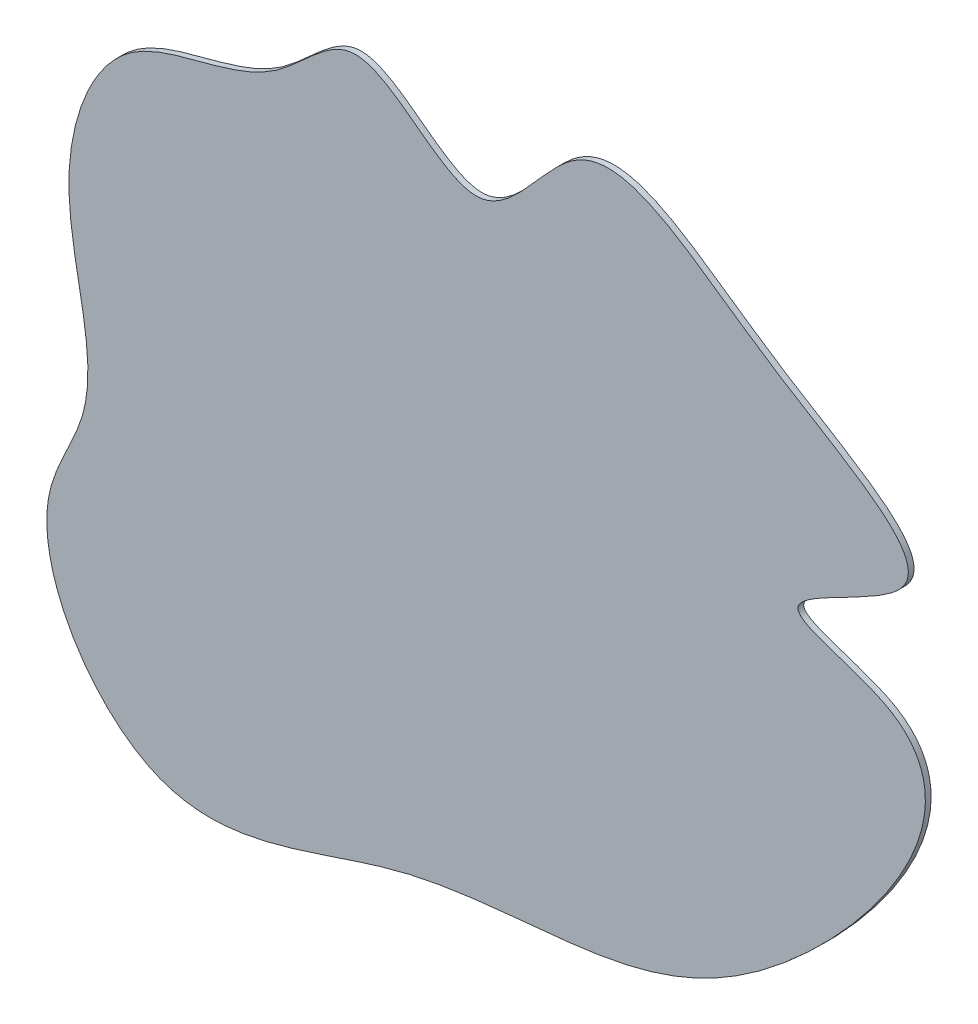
SolidWorks part; units mm, degrees
ref_plane "Plan de face" through (0, 0, 0) normal (0, 0, 1) x (1, 0, 0)
ref_plane "Plan de dessus" through (0, 0, 0) normal (0, 1, 0) x (1, 0, 0)
ref_plane "Plan de droite" through (0, 0, 0) normal (1, 0, 0) x (0, 0, -1)
sketch "Esquisse1" plane through (0, 0, 0) normal (0, 0, 1) x (1, 0, 0)
  spline S0 degree 3 poles (-6.8692, 51.3381) (-23.5656, 28.0856) (-49.8355, 29.489) (-62.3919, -3.5812) (-49.5735, -29.2286) (-67.8036, -55.1856) (-42.8025, -95.1435) (-1.7305, -71.9431) (37.385, -72.9632) (70.6226, -58.0375) (106.8975, -9.7323) (56.9158, -2.2767) (103.0983, 12.043) (58.3803, 33.1563) (33.0337, 58.8657) (13.5078, 22.1421) (-6.8692, 51.3381) (-23.5656, 28.0856) (-49.8355, 29.489) knots -0.12907 -0.085033 -0.034258 0 0.057183 0.112714 0.185714 0.219037 0.298383 0.389371 0.469137 0.539977 0.643888 0.680328 0.725797 0.790807 0.87093 0.914967 0.965742 1 1.057183 1.112714 1.185714 only from (-21.6614, 34.0549) to (-21.6614, 34.0549)
extrude "Extrusion1" add sketch "Esquisse1" along normal blind 1
